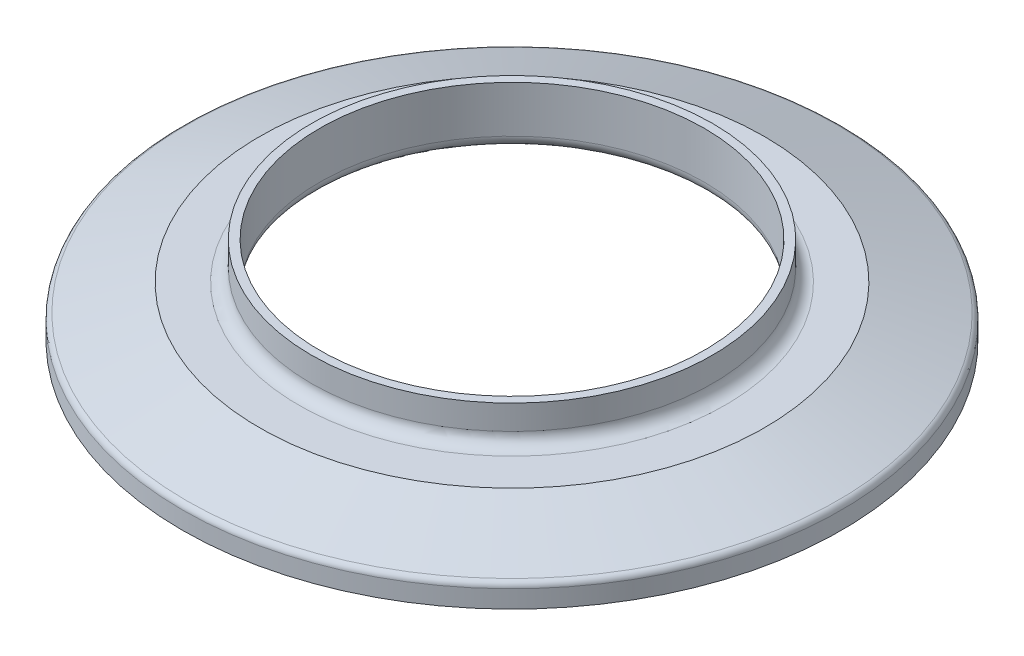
SolidWorks part; units mm, degrees
ref_plane "Front Plane" through (0, 0, 0) normal (0, 0, 1) x (1, 0, 0)
ref_plane "Top Plane" through (0, 0, 0) normal (0, 1, 0) x (1, 0, 0)
ref_plane "Right Plane" through (0, 0, 0) normal (1, 0, 0) x (0, 0, -1)
sketch "Sketch1" plane through (0, 0, 0) normal (0, 0, 1) x (1, 0, 0)
  line L0 (-73.406, 0) -> (-76.6296, 0)
  line L1 (-77.0972, 0.3095) -> (-77.3363, 0.8729)
  line L2 (-79.5341, 0.8729) -> (-79.7732, 0.3095)
  line L3 (-80.2408, 0) -> (-83.439, 0)
  line L4 (-83.439, 0) -> (-83.439, 4.4675)
  line L5 (-82.3861, 5.9712) -> (-63.8989, 12.7)
  line L6 (-63.8989, 12.7) -> (-53.975, 12.7)
  line L7 (-50.8, 15.875) -> (-50.8, 22.098)
  line L8 (-50.8, 22.098) -> (-48.6918, 22.098)
  line L9 (-48.6918, 22.098) -> (-48.6918, 10.2852)
  line L10 (-78.4352, 0.4064) -> (-78.4352, -7.4707) construction
  line L11 (0, 0) -> (0, 34.4262) construction
  line L12 (-73.406, 0) -> (-50.8919, 7.2636)
  arc A0 (-77.3363, 0.8729) -> (-79.5341, 0.8729) centre (-78.4352, 0.4064) ccw
  arc A1 (-53.975, 12.7) -> (-50.8, 15.875) centre (-53.975, 15.875) ccw
  arc A2 (-83.439, 4.4675) -> (-82.3861, 5.9712) centre (-81.8388, 4.4675) cw
  arc A3 (-76.6296, 0) -> (-77.0972, 0.3095) centre (-76.6296, 0.508) cw
  arc A4 (-80.2408, 0) -> (-79.7732, 0.3095) centre (-80.2408, 0.508) ccw
  arc A5 (-50.8919, 7.2636) -> (-48.6918, 10.2852) centre (-51.8668, 10.2852) ccw
  point P18 (-83.439, 5.588)
  dimension "D1" = 50.8
  dimension "D4" = 1.1938
  dimension "D11" = 3.175
  dimension "D12" = 1.6002
  dimension "D16" = 0.508
  dimension "D19" = 3.175
  dimension "D2" = 48.6918
  dimension "D3" = 5.588
  dimension "D5" = 0.4064
  dimension "D6" = 0.4064
  dimension "D7" = 23
  dimension "D8" = 23
  dimension "D9" = 12.7
  dimension "D10" = 20
  dimension "D13" = 78.4352
  dimension "D14" = 83.439
  dimension "D15" = 22.098
  dimension "D17" = 72.119
  dimension "D18" = 73.406
revolve "Revolve1" add sketch "Sketch1" angle 360 about L11
